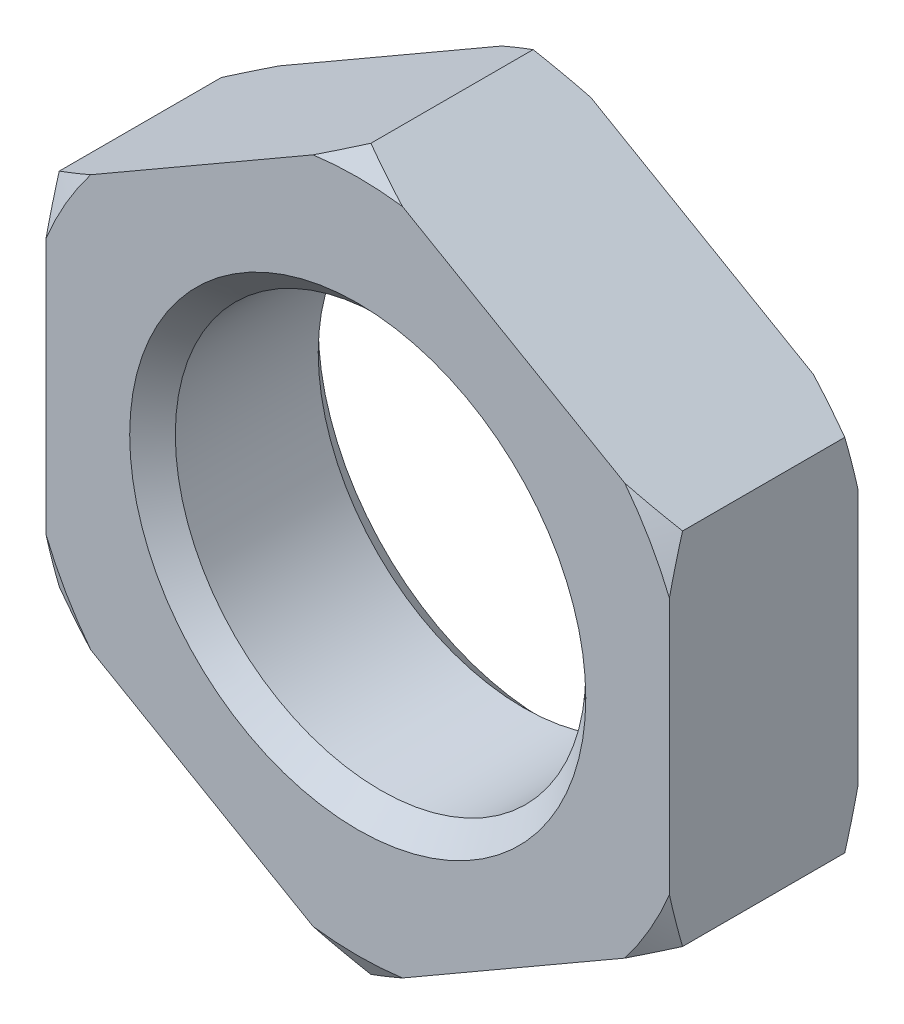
SolidWorks part; units mm, degrees
ref_plane "Front Plane" through (0, 0, 0) normal (0, 0, 1) x (1, 0, 0)
ref_plane "Top Plane" through (0, 0, 0) normal (0, 1, 0) x (1, 0, 0)
ref_plane "Right Plane" through (0, 0, 0) normal (1, 0, 0) x (0, 0, -1)
sketch "Sketch1" plane through (0, 0, 0) normal (0, 0, 1) x (1, 0, 0)
  line L1 (0, 23.6714) -> (-20.5, 11.8357)
  line L2 (-20.5, 11.8357) -> (-20.5, -11.8357)
  line L3 (-20.5, -11.8357) -> (0, -23.6714)
  line L4 (0, -23.6714) -> (20.5, -11.8357)
  line L5 (20.5, -11.8357) -> (20.5, 11.8357)
  line L6 (20.5, 11.8357) -> (0, 23.6714)
  circle A0 centre (0, 0) radius 20.5 construction
  circle A1 centre (0, 0) radius 13.5
  dimension "D2" = 27
  dimension "D1" = 41
extrude "Boss-Extrude1" add sketch "Sketch1" along normal mid plane 12.4
sketch "Sketch2" plane through (0, 0, 0) normal (1, 0, 0) x (0, 0, -1)
  line L0 (7.477, 0) -> (-8.5759, 0) construction
sketch "Sketch3" plane through (0, 0, 0) normal (1, 0, 0) x (0, 0, -1)
  line L0 (-6.2, 23.6714) -> (-6.2, 22.1714)
  line L1 (-6.2, 11.8357) -> (-6.2, 23.6714) construction
  line L2 (-6.2, 22.1714) -> (-5.334, 23.6714)
  line L3 (-6.2, 23.6714) -> (6.2, 23.6714) construction
  line L4 (-5.334, 23.6714) -> (-6.2, 23.6714)
  dimension "D1" = 1.5
  dimension "D2" = 30
revolve "Cut-Revolve1" cut sketch "Sketch3" angle 360 about L0
mirror "Mirror1" about plane through (0, 0, 0) normal (0, 0, 1) of "Cut-Revolve1"
chamfer "Chamfer1" distance 1.5 angle 45 2 edges at (13.5, 0, -6.2) (13.5, 0, 6.2)
